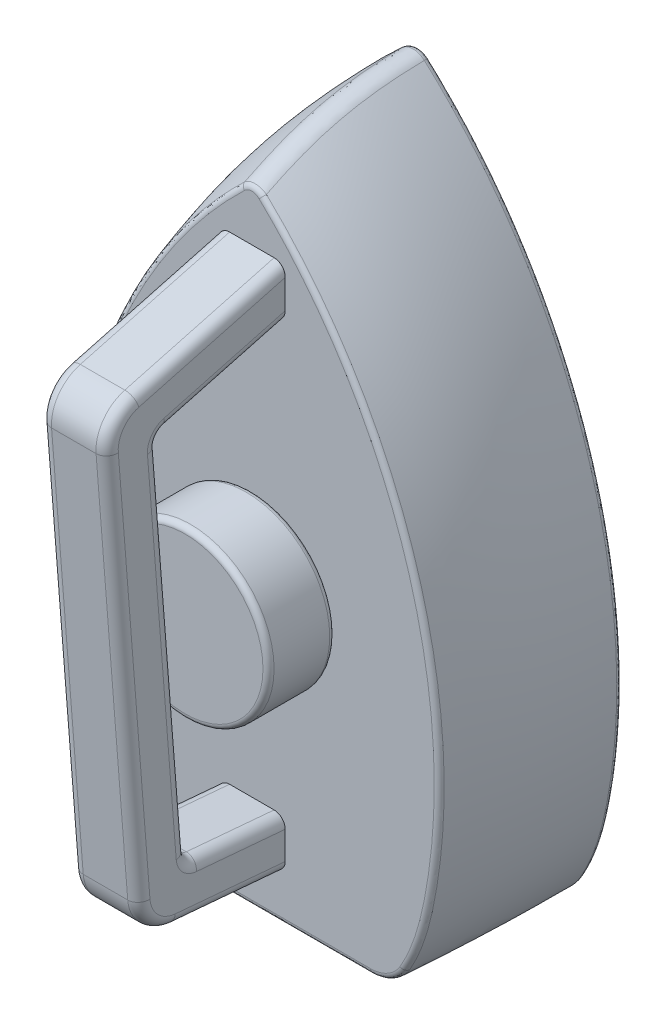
SolidWorks part; units mm, degrees
ref_plane "Front Plane" through (0, 0, 0) normal (0, 0, 1) x (1, 0, 0)
ref_plane "Top Plane" through (0, 0, 0) normal (0, 1, 0) x (1, 0, 0)
ref_plane "Right Plane" through (0, 0, 0) normal (1, 0, 0) x (0, 0, -1)
sketch "Sketch1" plane through (0, 0, 0) normal (0, 0, 1) x (1, 0, 0)
  line L0 (0, 0) -> (0, 120) construction
  line L2 (-21.3397, 0) -> (21.3397, 0)
  arc A4 (30, 5) -> (21.3397, 0) centre (21.3397, 10) cw
  arc A5 (-30, 5) -> (-21.3397, 0) centre (-21.3397, 10) ccw
  spline S0 degree 3 poles (0, 120) (27.7562, 96.266) (43.5219, 50.2642) (32.6872, 9.6544) (30, 5) knots 0 0 0 0 0.834899 0.955611 0.955611 0.955611 0.955611
  spline S1 degree 3 poles (0, 120) (-27.7562, 96.266) (-43.5219, 50.2642) (-32.6872, 9.6544) (-30, 5) knots 0 0 0 0 0.834899 0.955611 0.955611 0.955611 0.955611
  point P3 (30.1259, 82.3171)
  point P4 (-35.682, 16.1582)
  point P6 (0, 0)
  point P8 (0, 120)
  point P10 (0, 0)
  point P11 (26.4407, 85.8269)
  point P12 (-27.4341, 0)
  dimension "D2" = 10
  dimension "D3" = 38
  dimension "D4" = 20
  dimension "D1" = 120
  dimension "D5" = 70
  dimension "D6" = 55
  dimension "D7" = 5
  dimension "D8" = 60
ref_plane "Plane1" through (0, 0, 30) normal (0, 0, 1) x (1, 0, 0)
sketch "Sketch2" plane through (0, 0, 30) normal (0, 0, 1) x (1, 0, 0)
  line L3 (-21.3397, 0) -> (21.3397, 0)
  arc A6 (-27.4019, 3.5) -> (-21.3397, 0) centre (-21.3397, 7) ccw
  arc A7 (21.3397, 0) -> (27.4019, 3.5) centre (21.3397, 7) ccw
  spline S6 degree 3 poles (0, 113.0035) (-3.7339, 109.62) (-7.1362, 105.976) (-13.355, 98.2278) (-16.1708, 94.1231) (-19.3378, 88.715) (-19.9545, 87.6173) (-21.1457, 85.4064) (-21.7204, 84.2931) (-23.3827, 80.9307) (-24.409, 78.6589) (-27.2497, 71.7555) (-28.8277, 67.0367) (-30.4031, 60.9917) (-30.6982, 59.7753) (-31.2479, 57.3276) (-31.5027, 56.0943) (-32.2005, 52.3972) (-32.5786, 49.9299) (-33.4536, 42.5207) (-33.6931, 37.5715) (-33.5117, 30.1322) (-33.3607, 27.6499) (-32.9904, 23.9223) (-32.8429, 22.679) (-32.4983, 20.1912) (-32.3008, 18.9453) (-31.6368, 15.2373) (-31.1012, 12.794) (-29.6228, 8.0327) (-28.6805, 5.7146) (-27.4019, 3.5) knots 0 0 0 0 0.125 0.125 0.25 0.25 0.28125 0.28125 0.3125 0.3125 0.375 0.375 0.5 0.5 0.53125 0.53125 0.5625 0.5625 0.625 0.625 0.75 0.75 0.8125 0.8125 0.84375 0.84375 0.875 0.875 0.9375 0.9375 1 1 1 1
  spline S7 degree 3 poles (27.4019, 3.5) (28.6812, 5.7158) (29.623, 8.0336) (31.1006, 12.792) (31.6358, 15.2327) (32.2992, 18.936) (32.4967, 20.1801) (32.8418, 22.67) (32.9895, 23.9145) (33.3605, 27.6466) (33.5119, 30.1329) (33.6932, 37.5864) (33.4524, 42.5485) (32.7183, 48.7428) (32.5497, 49.9813) (32.1687, 52.4573) (31.956, 53.6971) (31.2549, 57.3986) (30.7051, 59.8375) (28.8165, 67.0705) (27.2403, 71.7814) (24.3993, 78.6811) (23.3724, 80.953) (21.708, 84.3175) (21.1325, 85.4318) (19.939, 87.6454) (19.3239, 88.7393) (16.1609, 94.1375) (13.3483, 98.2367) (7.1344, 105.9778) (3.7338, 109.62) (0, 113.0035) knots 0 0 0 0 0.0625 0.0625 0.125 0.125 0.15625 0.15625 0.1875 0.1875 0.25 0.25 0.375 0.375 0.40625 0.40625 0.4375 0.4375 0.5 0.5 0.625 0.625 0.6875 0.6875 0.71875 0.71875 0.75 0.75 0.875 0.875 1 1 1 1
loft "Loft1" add profiles "Sketch2", "Sketch1"
sketch "Sketch3" plane through (0, 0, 0) normal (0, 0, -1) x (-1, 0, 0)
  line L4 (-21.3397, 8) -> (0, 8)
  line L5 (0, 8) -> (21.3397, 8)
  arc A4 (-23.0718, 9) -> (-21.3397, 8) centre (-21.3397, 10) ccw
  arc A5 (21.3397, 8) -> (23.0718, 9) centre (21.3397, 10) ccw
  spline S4 degree 3 poles (-2892.9131, 703.724) (-120.4785, -60.1528) (9.3547, -39.2914) (26.3478, 17.4291) (26.8155, 19.6407) (27.4044, 22.9915) (27.5802, 24.1168) (27.8889, 26.3673) (28.0218, 27.4922) (28.3585, 30.8659) (28.5004, 33.1138) (28.6908, 39.8536) (28.5058, 44.3419) (27.7818, 51.0673) (27.4655, 53.3085) (26.6829, 57.786) (26.2205, 60.0005) (24.6271, 66.5734) (23.2913, 70.8619) (20.8808, 77.1556) (20.0091, 79.2302) (18.5967, 82.3063) (18.1084, 83.3257) (17.096, 85.3522) (16.571, 86.361) (13.8663, 91.3516) (11.456, 95.164) (-86.7349, 228.7467) (-509.3927, 119.7408) (-2657.2578, -1249.4893) knots -1.517397 -1.517397 -1.517397 -1.517397 0.0625 0.0625 0.125 0.125 0.15625 0.15625 0.1875 0.1875 0.25 0.25 0.375 0.375 0.4375 0.4375 0.5 0.5 0.625 0.625 0.6875 0.6875 0.71875 0.71875 0.75 0.75 0.875 0.875 5.354909 5.354909 5.354909 5.354909 only from (23.0718, 9) to (0, 109.0881)
  spline S5 degree 3 poles (2677.2703, -1210.5883) (498.8532, 129.0321) (85.0813, 226.5007) (-11.4535, 95.1672) (-13.858, 91.364) (-16.5545, 86.3923) (-17.0782, 85.387) (-18.0945, 83.3545) (-18.5867, 82.3277) (-20.007, 79.2359) (-20.8822, 77.1526) (-23.2998, 70.8384) (-24.6355, 66.5436) (-26.2263, 59.974) (-26.6874, 57.7627) (-27.2723, 54.4128) (-27.4496, 53.2891) (-27.7669, 51.0378) (-27.9064, 49.9129) (-28.5096, 44.2912) (-28.6909, 39.8043) (-28.435, 30.852) (-27.9981, 26.3865) (-27.0234, 20.8194) (-26.8084, 19.7067) (-26.3126, 17.4836) (-26.0309, 16.3726) (-8.7519, -41.3681) (128.9914, -52.1008) (2834.5274, 913.303) knots -4.282689 -4.282689 -4.282689 -4.282689 0.125 0.125 0.25 0.25 0.28125 0.28125 0.3125 0.3125 0.375 0.375 0.5 0.5 0.5625 0.5625 0.59375 0.59375 0.625 0.625 0.75 0.75 0.875 0.875 0.90625 0.90625 0.9375 0.9375 2.561748 2.561748 2.561748 2.561748 only from (0, 109.0881) to (-23.0718, 9)
  spline S6 degree 3 poles (23.0718, 9) (24.2302, 11.0065) (25.0545, 13.1122) (26.3478, 17.4291) (26.8155, 19.6407) (27.4044, 22.9915) (27.5802, 24.1168) (27.8889, 26.3673) (28.0218, 27.4922) (28.3585, 30.8659) (28.5004, 33.1138) (28.6908, 39.8536) (28.5058, 44.3419) (27.7818, 51.0673) (27.4655, 53.3085) (26.6829, 57.786) (26.2205, 60.0005) (24.6271, 66.5734) (23.2913, 70.8619) (20.8808, 77.1556) (20.0091, 79.2302) (18.5967, 82.3063) (18.1084, 83.3257) (17.096, 85.3522) (16.571, 86.361) (13.8663, 91.3516) (11.456, 95.164) (6.1252, 102.4162) (3.2051, 105.8562) (0, 109.0881) knots 0 0 0 0 0.0625 0.0625 0.125 0.125 0.15625 0.15625 0.1875 0.1875 0.25 0.25 0.375 0.375 0.4375 0.4375 0.5 0.5 0.625 0.625 0.6875 0.6875 0.71875 0.71875 0.75 0.75 0.875 0.875 1 1 1 1
  spline S7 degree 3 poles (0, 109.0881) (-3.2097, 105.8516) (-6.1292, 102.4109) (-11.4535, 95.1672) (-13.858, 91.364) (-16.5545, 86.3923) (-17.0782, 85.387) (-18.0945, 83.3545) (-18.5867, 82.3277) (-20.007, 79.2359) (-20.8822, 77.1526) (-23.2998, 70.8384) (-24.6355, 66.5436) (-26.2263, 59.974) (-26.6874, 57.7627) (-27.2723, 54.4128) (-27.4496, 53.2891) (-27.7669, 51.0378) (-27.9064, 49.9129) (-28.5096, 44.2912) (-28.6909, 39.8043) (-28.435, 30.852) (-27.9981, 26.3865) (-27.0234, 20.8194) (-26.8084, 19.7067) (-26.3126, 17.4836) (-26.0309, 16.3726) (-25.0524, 13.1028) (-24.2212, 10.9909) (-23.0718, 9) knots 0 0 0 0 0.125 0.125 0.25 0.25 0.28125 0.28125 0.3125 0.3125 0.375 0.375 0.5 0.5 0.5625 0.5625 0.59375 0.59375 0.625 0.625 0.75 0.75 0.875 0.875 0.90625 0.90625 0.9375 0.9375 1 1 1 1
  dimension "D1" = 8
sketch "Sketch4" plane through (0, 0, 0) normal (0, 0, -1) x (-1, 0, 0)
  circle A0 centre (-23.0718, 9) radius 3
  dimension "D1" = 6
extrude "Cut-Extrude1" cut sketch "Sketch4" against normal blind 2
pattern_curve "CrvPattern2" of "Cut-Extrude1" parameters "D1"=7, "D3"=15.25, "D2"=1, "D4"=10
mirror "Mirror1" about plane through (0, 0, 0) normal (1, 0, 0) of "CrvPattern2", "Cut-Extrude1"
sketch "Sketch5" plane through (0, 0, 0) normal (0, 0, -1) x (-1, 0, 0)
  circle A0 centre (0, 109.0881) radius 3
  dimension "D1" = 6
extrude "Cut-Extrude2" cut sketch "Sketch5" against normal blind 2
fillet "Fillet1" radius 3 1 edges
fillet "Fillet2" radius 1 14 edges at (0.2176, 111.9761, 30)
sketch "Sketch6" plane through (0, 0, 30) normal (0, 0, 1) x (1, 0, 0)
  circle A0 centre (0, 50) radius 15
  point P2 (0, 0)
  dimension "D1" = 30
  dimension "D2" = 50
extrude "Boss-Extrude1" add sketch "Sketch6" along normal blind 12 separate body
fillet "Fillet3" radius 1 2 edges at (15, 50, 42) (15, 50, 30)
sketch "Sketch7" plane through (0, 0, 0) normal (1, 0, 0) x (0, 0, -1)
  line L0 (-30, 103) -> (-56.8333, 95.81)
  line L1 (-30, 46.0323) -> (-30, -46.0323) construction
  line L2 (-62, 88.4993) -> (-56.3074, 16.1686)
  line L3 (-49.9391, 9.7444) -> (-30, 8)
  arc A0 (-56.8333, 95.81) -> (-62, 88.4993) centre (-55.0216, 89.0486) ccw
  arc A1 (-56.3074, 16.1686) -> (-49.9391, 9.7444) centre (-49.329, 16.7178) ccw
  dimension "D1" = 95
  dimension "D5" = 7
  dimension "D6" = 7
  dimension "D2" = 8
  dimension "D3" = 4.5
  dimension "D4" = 32
  dimension "D7" = 85
  dimension "D8" = 75
extrude "Extrude-Thin1" add sketch "Sketch7" along normal mid plane 12 separate body thin
fillet "Fillet4" radius 2 18 edges at (6, 99.405, 43.4167) (6, 93.0886, 60.7381) (6, 52.334, 59.1537) (6, 8.8722, 39.9696) (-6, 99.405, 43.4167) (-6, 93.0886, 60.7381) (-6, 8.8722, 39.9696) (-6, 11.7897, 54.3003) (6, 17.7642, 38.3418) (6, 90.9269, 40.2839) (6, 53.0549, 50.1826) (0, 18.5626, 47.468) (0, 87.5472, 52.8972) (-6, 17.7642, 38.3418) (-6, 53.0549, 50.1826) (-6, 90.9269, 40.2839) (6, 11.7897, 54.3003) (-6, 52.334, 59.1537)
sketch "Sketch8" plane through (0, 0, 0) normal (0, 0, -1) x (-1, 0, 0)
  circle A0 centre (0, 40) radius 3
  circle A5 centre (0, 56) radius 3
  circle A6 centre (13.8564, 48) radius 3
  circle A7 centre (13.8564, 32) radius 3
  circle A8 centre (0, 24) radius 3
  circle A9 centre (-13.8564, 32) radius 3
  circle A10 centre (-13.8564, 48) radius 3
  point P2 (0, 0)
  point P7 (0, 61)
  point P8 (0, 0)
  point P19 (0, 40)
  point P20 (0, 45)
  dimension "D1" = 6
  dimension "D3" = 6
  dimension "D2" = 40
  dimension "D4" = 6
  dimension "D5" = 16
extrude "Cut-Extrude4" cut sketch "Sketch8" against normal blind 2
sketch "Sketch9" plane through (0, 0, 30) normal (0, 0, 1) x (1, 0, 0)
  line L4 (4, 103) -> (-4, 103)
  line L5 (6, 96.2385) -> (6, 101.0681)
  line L6 (-4, 94.3067) -> (4, 94.3067)
  line L7 (-6, 101.0681) -> (-6, 96.2385)
  line L8 (4, 103) -> (-4, 103)
  line L9 (6, 96.2385) -> (6, 101.0681)
  line L10 (-4, 94.3067) -> (4, 94.3067)
  line L11 (-6, 101.0681) -> (-6, 96.2385)
  line L12 (6, 9.9924) -> (6, 14.9734)
  line L13 (-4, 8) -> (4, 8)
  line L14 (-6, 14.9734) -> (-6, 9.9924)
  line L15 (4, 16.9658) -> (-4, 16.9658)
  line L16 (6, 9.9924) -> (6, 14.9734)
  line L17 (-4, 8) -> (4, 8)
  line L18 (-6, 14.9734) -> (-6, 9.9924)
  line L19 (4, 16.9658) -> (-4, 16.9658)
  ellipse E4 centre (4, 101.0681) end of major axis (6, 101.0681) minor radius 1.9319 (6, 101.0681) -> (4, 103) ccw
  ellipse E5 centre (4, 96.2385) end of major axis (6, 96.2385) minor radius 1.9319 (4, 94.3067) -> (6, 96.2385) ccw
  ellipse E6 centre (-4, 96.2385) end of major axis (-2, 96.2385) minor radius 1.9319 (-6, 96.2385) -> (-4, 94.3067) ccw
  ellipse E7 centre (-4, 101.0681) end of major axis (-2, 101.0681) minor radius 1.9319 (-4, 103) -> (-6, 101.0681) ccw
  ellipse E8 centre (4, 101.0681) end of major axis (6, 101.0681) minor radius 1.9319 (6, 101.0681) -> (4, 103) ccw
  ellipse E9 centre (4, 96.2385) end of major axis (6, 96.2385) minor radius 1.9319 (4, 94.3067) -> (6, 96.2385) ccw
  ellipse E10 centre (-4, 96.2385) end of major axis (-2, 96.2385) minor radius 1.9319 (-6, 96.2385) -> (-4, 94.3067) ccw
  ellipse E11 centre (-4, 101.0681) end of major axis (-2, 101.0681) minor radius 1.9319 (-4, 103) -> (-6, 101.0681) ccw
  ellipse E12 centre (4, 9.9924) end of major axis (6, 9.9924) minor radius 1.9924 (4, 8) -> (6, 9.9924) ccw
  ellipse E13 centre (-4, 9.9924) end of major axis (-6, 9.9924) minor radius 1.9924 (-6, 9.9924) -> (-4, 8) ccw
  ellipse E14 centre (-4, 14.9734) end of major axis (-6, 14.9734) minor radius 1.9924 (-4, 16.9658) -> (-6, 14.9734) ccw
  ellipse E15 centre (4, 14.9734) end of major axis (6, 14.9734) minor radius 1.9924 (6, 14.9734) -> (4, 16.9658) ccw
  ellipse E16 centre (4, 9.9924) end of major axis (6, 9.9924) minor radius 1.9924 (4, 8) -> (6, 9.9924) ccw
  ellipse E17 centre (-4, 9.9924) end of major axis (-6, 9.9924) minor radius 1.9924 (-6, 9.9924) -> (-4, 8) ccw
  ellipse E18 centre (-4, 14.9734) end of major axis (-6, 14.9734) minor radius 1.9924 (-4, 16.9658) -> (-6, 14.9734) ccw
  ellipse E19 centre (4, 14.9734) end of major axis (6, 14.9734) minor radius 1.9924 (6, 14.9734) -> (4, 16.9658) ccw
  dimension "D1" = 0
  dimension "D2" = 0
extrude "Boss-Extrude2" add sketch "Sketch9" against normal blind 10
move or copy body "Body-Move/Copy1" bodies to move or copy 110 copy yes number of copies 1 translate (0, 0, 0)
combine bodies "Combine1" operation type subtract main body 109 bodies to subtract 110
